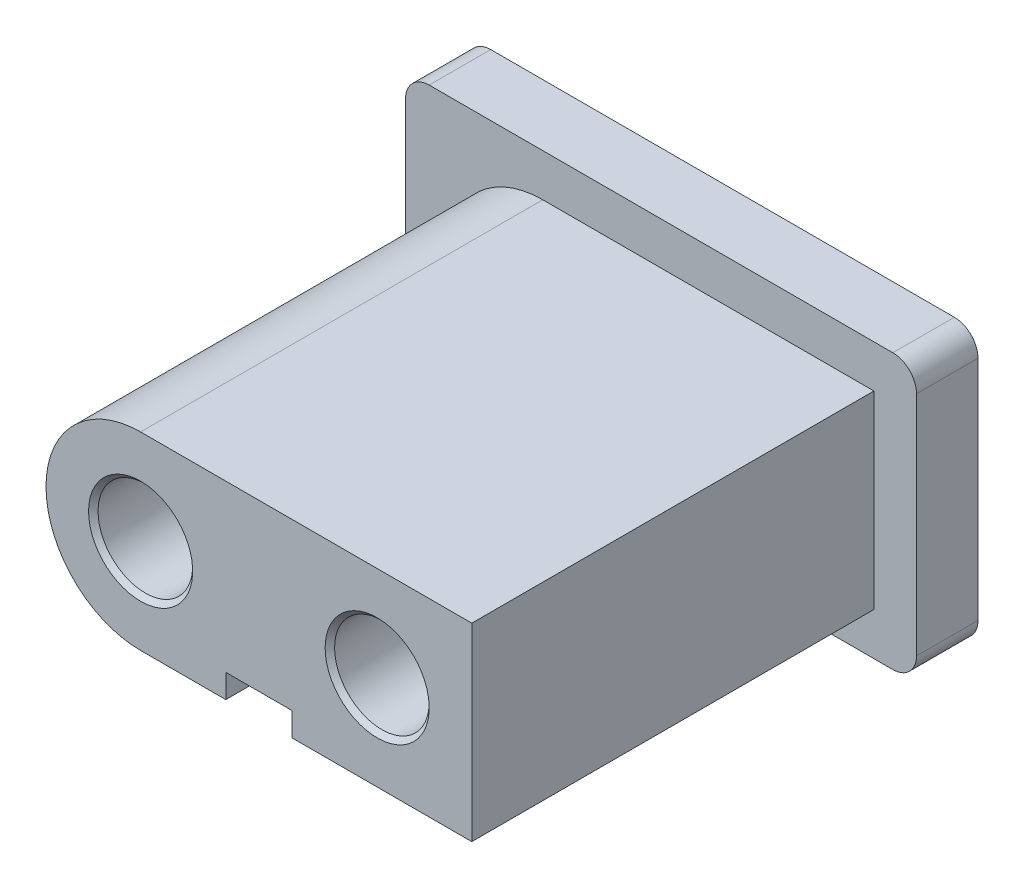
SolidWorks part; units mm, degrees
ref_plane "前视基准面" through (0, 0, 0) normal (0, 0, 1) x (1, 0, 0)
ref_plane "上视基准面" through (0, 0, 0) normal (0, 1, 0) x (1, 0, 0)
ref_plane "右视基准面" through (0, 0, 0) normal (1, 0, 0) x (0, 0, -1)
sketch "草图1" plane through (0, 0, 0) normal (0, 0, 1) x (1, 0, 0)
  line L1 (-4.9, 2.9) -> (4.9, 2.9)
  line L2 (-5.4, 2.4) -> (-5.4, -2.4)
  line L3 (-4.9, -2.9) -> (4.9, -2.9)
  line L4 (5.4, 2.4) -> (5.4, -2.4)
  line L5 (-5.4, 2.9) -> (5.4, -2.9) construction
  line L6 (-5.4, -2.9) -> (5.4, 2.9) construction
  arc A0 (4.9, -2.9) -> (5.4, -2.4) centre (4.9, -2.4) ccw
  arc A1 (4.9, 2.9) -> (5.4, 2.4) centre (4.9, 2.4) cw
  arc A2 (-5.4, -2.4) -> (-4.9, -2.9) centre (-4.9, -2.4) ccw
  arc A3 (-4.9, 2.9) -> (-5.4, 2.4) centre (-4.9, 2.4) ccw
  point P0 (0, 0)
  dimension "D3" = 0.5
  dimension "D1" = 10.8
  dimension "D2" = 5.8
extrude "凸台-拉伸1" add sketch "草图1" along normal blind 1.3
sketch "草图2" plane through (0, 0, 1.3) normal (0, 0, 1) x (1, 0, 0)
  line L0 (-8.4071, 0) -> (8.869, 0) construction
  line L1 (0, 4.7921) -> (0, -5.4165) construction
  line L3 (-4.5, 2) -> (4.5, 2)
  line L4 (-4.5, 2) -> (-4.5, -2)
  line L5 (-4.5, -2) -> (-0.7, -2)
  line L6 (4.5, 2) -> (4.5, -2)
  line L7 (-4.5, 2) -> (4.5, -2) construction
  line L8 (-4.5, -2) -> (4.5, 2) construction
  line L9 (0.7, -2) -> (0.7, -1.5)
  line L10 (-0.7, -2) -> (-0.7, -1.5)
  line L11 (0.7, -1.5) -> (-0.7, -1.5)
  line L14 (0.7, -2) -> (4.5, -2)
  circle A0 centre (2.5, 0) radius 1
  circle A1 centre (-2.5, 0) radius 1
  point P5 (0, 0)
  point P11 (0, -2)
  point P12 (-0.7, -1.75)
  point P13 (0.7, -1.75)
  dimension "D8" = 2
  dimension "D9" = 2
  dimension "D1" = 4
  dimension "D2" = 9
  dimension "D3" = 0.7
  dimension "D4" = 0.5
  dimension "D5" = 1.4
  dimension "D6" = 2
  dimension "D7" = 0.25
extrude "凸台-拉伸2" add sketch "草图2" along normal blind 8.5
fillet "圆角1" radius 2 2 edges at (-4.5, 2, 5.55) (-4.5, -2, 5.55)
chamfer "倒角2" distance 0.1 angle 45 2 edges at (3.5, 0, 9.8) (-3.5, 0, 9.8)
